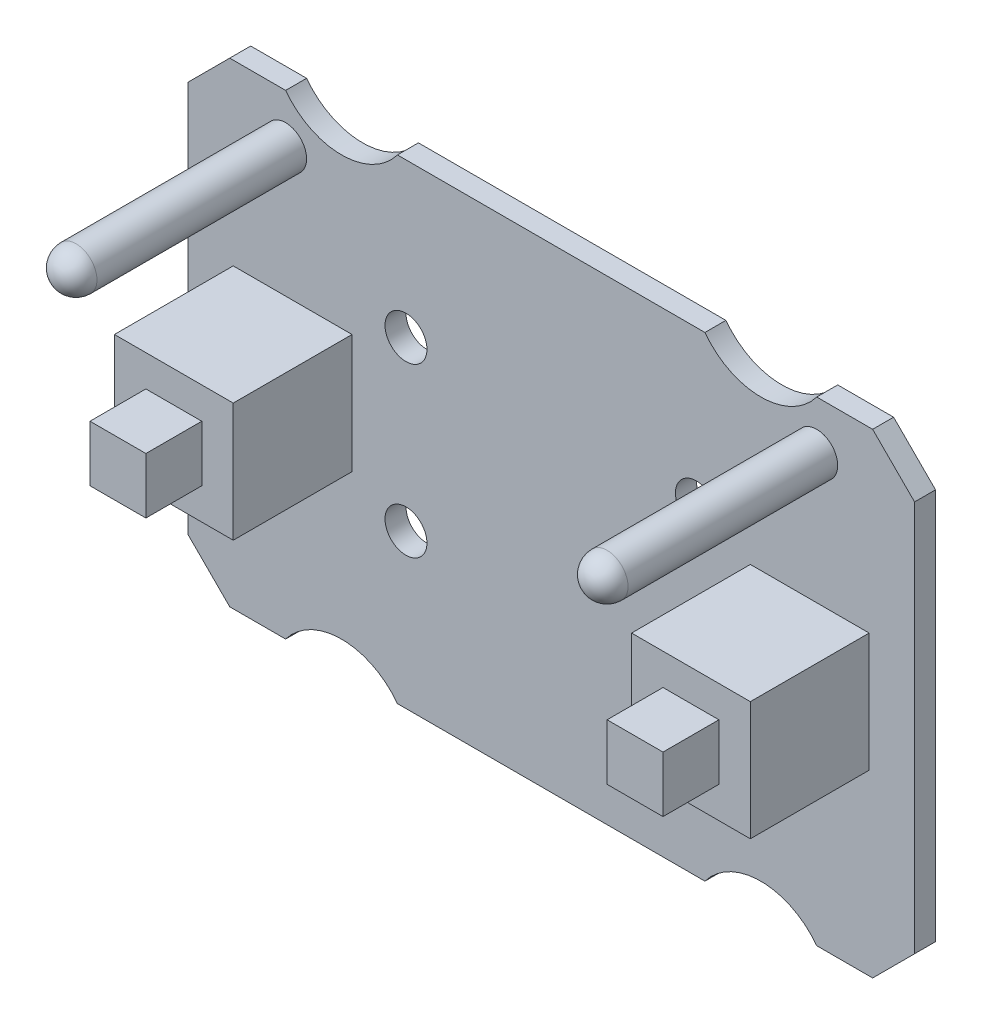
SolidWorks part; units mm, degrees
ref_plane "Face" through (0, 0, 0) normal (0, 0, 1) x (1, 0, 0)
ref_plane "Dessus" through (0, 0, 0) normal (0, 1, 0) x (1, 0, 0)
ref_plane "Droite" through (0, 0, 0) normal (1, 0, 0) x (0, 0, -1)
sketch "Esquisse1" plane through (0, 0, 0) normal (0, 0, 1) x (1, 0, 0)
  line L1 (-26, 17) -> (26, 17)
  line L2 (-26, 17) -> (-26, -17)
  line L3 (-26, -17) -> (26, -17)
  line L4 (26, 17) -> (26, -17)
  dimension "D1" = 52
  dimension "D2" = 26
  dimension "D3" = 34
  dimension "D4" = 17
extrude "Extrusion1" add sketch "Esquisse1" along normal blind 1.5
chamfer "Chanfrein1" distance 3 angle 45 4 edges at (-26, 17, 0.75) (26, 17, 0.75) (26, -17, 0.75) (-26, -17, 0.75)
sketch "Esquisse2" plane through (0, 0, 1.5) normal (0, 0, 1) x (1, 0, 0)
  circle A0 centre (-15, 20) radius 5
  circle A1 centre (15, 20) radius 5
  circle A2 centre (-15, -20) radius 5
  circle A3 centre (15, -20) radius 5
  dimension "D1" = 10
  dimension "D2" = 10
  dimension "D3" = 10
  dimension "D4" = 10
  dimension "D12" = 15
  dimension "D5" = 40
  dimension "D6" = 40
  dimension "D7" = 20
  dimension "D8" = 20
  dimension "D9" = 30
  dimension "D10" = 30
  dimension "D11" = 15
extrude "Enlèv. mat.-Extru.1" cut sketch "Esquisse2" against normal through all
sketch "Esquisse3" plane through (0, 0, 1.5) normal (0, 0, 1) x (1, 0, 0)
  circle A0 centre (-19, 13.5) radius 1.5
  circle A1 centre (19, 13.5) radius 1.5
  dimension "D1" = 3
  dimension "D2" = 3
  dimension "D3" = 19
  dimension "D4" = 19
  dimension "D5" = 13.5
  dimension "D6" = 13.5
extrude "Extrusion2" add sketch "Esquisse3" along normal blind 16.5
fillet "Congé2" radius 1.5 2 edges at (-17.5, 13.5, 18) (20.5, 13.5, 18)
sketch "Esquisse4" plane through (0, 0, 1.5) normal (0, 0, 1) x (1, 0, 0)
  line L1 (-22.75, 4.25) -> (-14.25, 4.25)
  line L2 (-22.75, 4.25) -> (-22.75, -4.25)
  line L3 (-22.75, -4.25) -> (-14.25, -4.25)
  line L4 (-14.25, 4.25) -> (-14.25, -4.25)
  dimension "D1" = 8.5
  dimension "D2" = 8.5
  dimension "D3" = 4.25
  dimension "D4" = 14.25
extrude "Extrusion3" add sketch "Esquisse4" along normal blind 8.5
sketch "Esquisse5" plane through (0, 0, 10) normal (0, 0, 1) x (1, 0, 0)
  line L0 (-22.75, 4.25) -> (-22.75, -4.25) construction
  line L1 (-20.5, 2) -> (-16.5, 2)
  line L2 (-20.5, 2) -> (-20.5, -2)
  line L3 (-20.5, -2) -> (-16.5, -2)
  line L4 (-16.5, 2) -> (-16.5, -2)
  line L5 (-14.25, 4.25) -> (-22.75, 4.25) construction
  dimension "D1" = 4
  dimension "D2" = 4
  dimension "D3" = 2.25
  dimension "D4" = 2.25
extrude "Extrusion4" add sketch "Esquisse5" along normal blind 4
pattern_linear "Répétition linéaire1" count 2 spacing 37 along (1, 0, 0) of "Extrusion3", "Extrusion4"
sketch "Esquisse6" plane through (0, 0, 1.5) normal (0, 0, 1) x (1, 0, 0)
  circle A0 centre (-10.39, 6) radius 1.5
  dimension "D1" = 3
  dimension "D2" = 10.39
  dimension "D3" = 6
extrude "Enlèv. mat.-Extru.2" cut sketch "Esquisse6" against normal through all
pattern_linear "Répétition linéaire2" count 2 spacing 20.78 along (1, 0, 0) count 2 spacing 12 along (0, -1, 0) of "Enlèv. mat.-Extru.2"
sketch "Esquisse7" plane through (0, 0, 0) normal (0, 0, -1) x (-1, 0, 0)
  line L0 (26, 14) -> (26, -14) construction
  line L1 (23, -17) -> (19, -17) construction
  circle A0 centre (22.5, -12.5) radius 0.3
  dimension "D1" = 0.6
  dimension "D3" = 4.5
  dimension "D2" = 3.5
extrude "Extrusion5" add sketch "Esquisse7" along normal blind 5
pattern_linear "Répétition linéaire3" count 4 spacing 2 along (0, 1, 0) of "Extrusion5"
